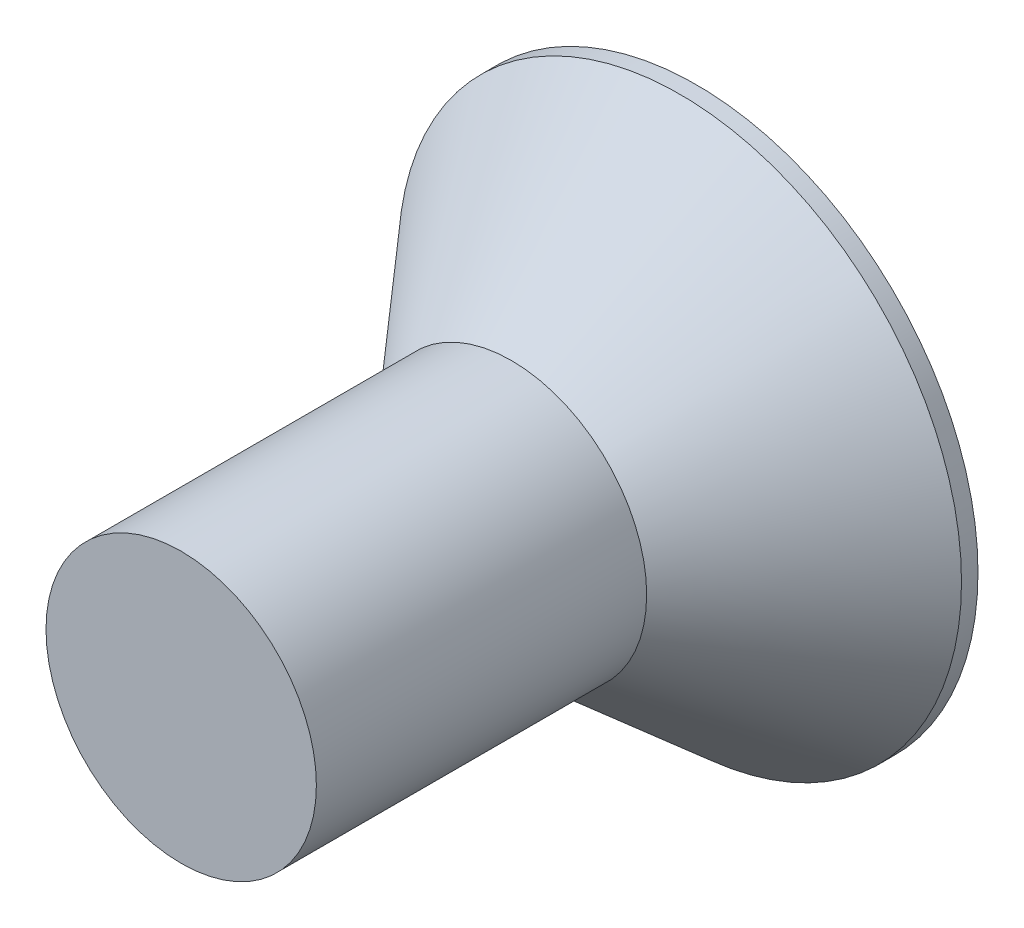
SolidWorks part; units mm, degrees
ref_plane "Front Plane" through (0, 0, 0) normal (0, 0, 1) x (1, 0, 0)
ref_plane "Top Plane" through (0, 0, 0) normal (0, 1, 0) x (1, 0, 0)
ref_plane "Right Plane" through (0, 0, 0) normal (1, 0, 0) x (0, 0, -1)
sketch "Sketch6" plane through (0, 0, 0) normal (1, 0, 0) x (0, 0, -1)
  line L0 (-7.9375, 0) -> (22.525, 0) construction
  line L1 (4.7724, 0) -> (-4.7724, 0) construction
  line L2 (-7.9375, 0) -> (-7.9375, -2.0828)
  line L3 (-7.9375, -2.0828) -> (-2.8489, -2.0828)
  line L4 (0, -4.3385) -> (-0.254, -4.3385)
  line L6 (-2.8489, -2.0828) -> (-0.254, -4.3385)
  line L7 (0, -4.3385) -> (0, 0)
  line L8 (0, 0) -> (-7.9375, 0)
  dimension "D1" = 41
  dimension "D2" = 0.254
  dimension "L" = 7.9375
  dimension "D3" = 8.677
  dimension "D" = 4.1656
revolve "Revolve1" add sketch "Sketch6" angle 360 about L0
sketch "Sketch7" plane through (0, 0, 0) normal (0, 0, -1) x (-1, 0, 0)
  line L2 (-1.1811, 0.6819) -> (-1.1811, -0.6819)
  line L4 (-1.1811, -0.6819) -> (0, -1.3638)
  line L5 (0, -1.3638) -> (1.1811, -0.6819)
  line L6 (1.1811, -0.6819) -> (1.1811, 0.6819)
  line L7 (1.1811, 0.6819) -> (0, 1.3638)
  line L8 (0, 1.3638) -> (-1.1811, 0.6819)
  circle A0 centre (0, 0) radius 1.1811 construction
  dimension "J" = 2.3622
extrude "HEX" cut sketch "Sketch7" against normal blind 2.794
